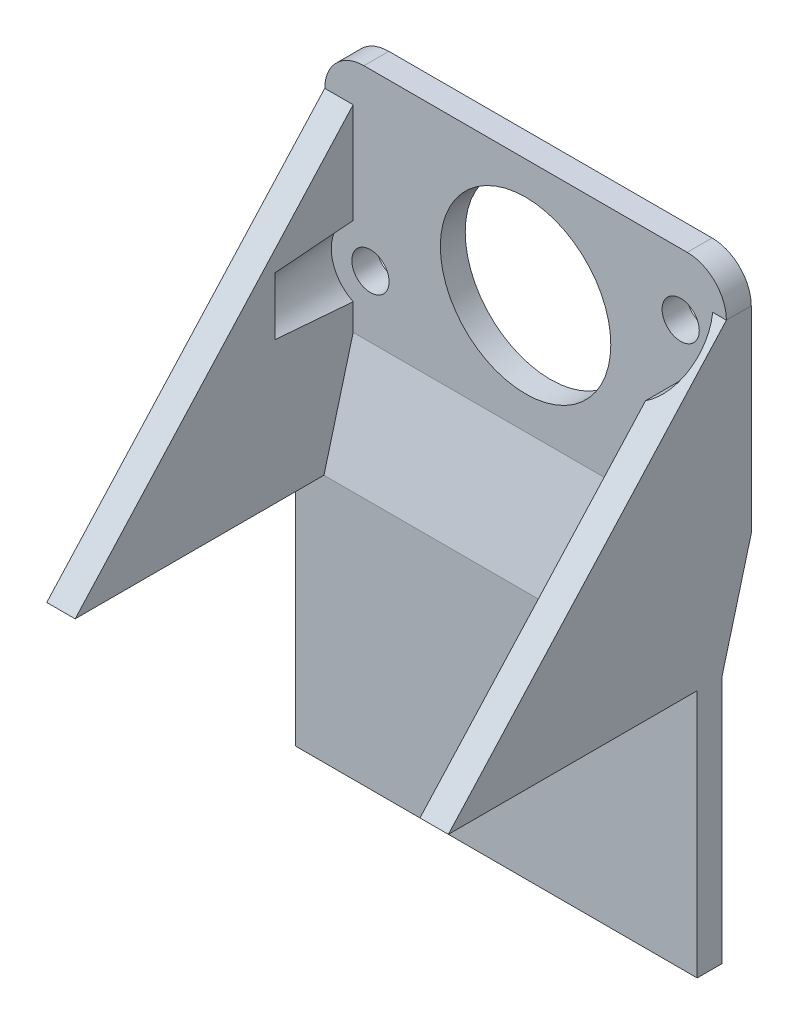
SolidWorks part; units mm, degrees
ref_plane "Front Plane" through (0, 0, 0) normal (0, 0, 1) x (1, 0, 0)
ref_plane "Top Plane" through (0, 0, 0) normal (0, 1, 0) x (1, 0, 0)
ref_plane "Right Plane" through (0, 0, 0) normal (1, 0, 0) x (0, 0, -1)
sketch "Sketch1" plane through (0, 0, 0) normal (0, 0, 1) x (1, 0, 0)
  line L1 (-51.25, -30.1625) -> (51.25, -30.1625)
  line L2 (-51.25, -30.1625) -> (-51.25, 30.1625)
  line L4 (51.25, -30.1625) -> (51.25, 30.1625)
  line L5 (-51.25, -30.1625) -> (51.25, 30.1625) construction
  line L6 (-51.25, 30.1625) -> (51.25, -30.1625) construction
  line L12 (0, 0) -> (50000, 0) construction
  line L13 (-51.25, 30.1625) -> (51.25, 30.1625)
  circle A2 centre (0, 0) radius 21.75
  point P0 (0, 0)
  point P19 (0, 0)
  dimension "D2" = 43.5
  dimension "D3" = 102.5
  dimension "D4" = 60.325
extrude "Boss-Extrude1" add sketch "Sketch1" along normal blind 6.35
sketch "Sketch4" [suppressed] plane through (0, 0, 0) normal (0, 0, 1) x (1, 0, 0)
  line L0 (51.25, 30.1625) -> (56.25, 30.1625)
  line L1 (-56.25, -30.1625) -> (-51.25, -30.1625)
  line L2 (-56.25, -30.1625) -> (-56.25, 30.1625)
  line L3 (-56.25, 30.1625) -> (-51.25, 30.1625)
  line L4 (56.25, -30.1625) -> (56.25, 30.1625)
  line L6 (-51.25, 30.1625) -> (-51.25, -30.1625)
  line L8 (51.25, 30.1625) -> (51.25, -30.1625)
  line L13 (51.25, -30.1625) -> (51.25, 30.1625) construction
  line L14 (51.25, -30.1625) -> (56.25, -30.1625)
  line L15 (-51.25, 30.1625) -> (-51.25, -30.1625) construction
  line L16 (51.25, 30.1625) -> (-51.25, 30.1625) construction
  line L17 (-51.25, -30.1625) -> (51.25, -30.1625) construction
  dimension "D1" = 5
fillet "Fillet1" radius 10 2 edges at (-51.25, 30.1625, 3.175) (51.25, 30.1625, 3.175)
sketch "Sketch5" plane through (0, 0, 0) normal (0, 0, 1) x (1, 0, 0)
  line L0 (-40.6896, -10.9028) -> (40.6896, 10.9028) construction
  line L2 (41.25, 30.1625) -> (-41.25, 30.1625) construction
  circle A0 centre (-40.6896, -10.9028) radius 4.75
  circle A1 centre (40.6896, 10.9028) radius 4.75
  point P8 (0, 0)
  dimension "9.5" = 9.5
  dimension "D1" = 15
  dimension "D2" = 84.25
sketch "Sketch2" plane through (0, 0, 0) normal (0, 0, 1) x (1, 0, 0)
  line L0 (-39.5846, -14.4076) -> (39.5846, 14.4076) construction
  line L1 (41.25, 30.1625) -> (-41.25, 30.1625) construction
  circle A0 centre (-39.5846, -14.4076) radius 4.75
  circle A1 centre (39.5846, 14.4076) radius 4.75
  point P8 (0, 0)
  dimension "9.5" = 9.5
  dimension "D1" = 20
  dimension "D2" = 84.25
extrude "Cut-Extrude1" cut sketch "Sketch2" along normal up to surface (6.35 mm away)
sketch "Sketch3" [suppressed] plane through (0, 0, 0) normal (0, 0, 1) x (1, 0, 0)
  line L0 (43.75, 0) -> (-43.75, 0) construction
  circle A0 centre (-43.75, 0) radius 4.75
  circle A1 centre (43.75, 0) radius 4.75
  point P9 (0, 0)
  dimension "D2" = 9.5
  dimension "D1" = 87.5
extrude "Cut-Extrude2" [suppressed] cut sketch "Sketch3" along normal up to surface (6.35 mm away)
extrude "Boss-Extrude2" [suppressed] add sketch "Sketch4" along normal up to surface (6.35 mm away)
fillet "Fillet2" [suppressed] radius 6
sketch "Sketch6" [suppressed] plane through (0, 0, 0) normal (1, 0, 0) x (0, 0, -1)
  line L0 (0, -30.1625) -> (12.55, -58)
  line L1 (12.55, -58) -> (12.55, -117.5)
  line L2 (12.55, -117.5) -> (6.2, -117.5)
  line L3 (6.2, -117.5) -> (6.2, -58)
  line L4 (6.2, -58) -> (-6.35, -30.1625)
  line L5 (0, -30.1625) -> (-6.35, -30.1625) construction
  line L7 (-6.35, -30.1625) -> (0, -30.1625)
  line L9 (-3.8, -119.5) -> (-3.8, -60) construction
extrude "Boss-Extrude3" [suppressed] add sketch "Sketch6" along normal mid plane 100
sketch "Sketch7" plane through (0, 0, 0) normal (1, 0, 0) x (0, 0, -1)
  line L0 (-6.35, -30.1625) -> (0, -30.1625)
  line L2 (0, -30.1625) -> (-7.45, -58)
  line L3 (-7.45, -58) -> (-7.45, -121.5)
  line L4 (-7.45, -121.5) -> (-13.8, -121.5)
  line L5 (-13.8, -121.5) -> (-13.8, -58)
  line L6 (-13.8, -58) -> (-6.35, -30.1625)
  line L7 (-13.8, -119.5) -> (-13.8, -60) construction
  line L8 (-13.8, -58) -> (-13.8, -121.5) construction
  point P3 (0, -30.1625)
  point P4 (0.9462, -30.1625)
  point P6 (0, -30.1625)
  point P14 (0, 0)
  point P17 (-4.9522, -30.1625)
  point P19 (0, 0)
  point P20 (-1.3049, -30.1625)
  point P21 (0, 0)
extrude "Boss-Extrude4" add sketch "Sketch7" along normal mid plane 102.5
sketch "Sketch8" plane through (0, 0, 0) normal (1, 0, 0) x (0, 0, -1)
  line L0 (-7.45, -121.5) -> (0, -30.1625)
  line L1 (0, -30.1625) -> (-7.45, -58)
  line L2 (-7.45, -58) -> (-7.45, -121.5)
  point P3 (0.7414, -31.0281)
  point P4 (1.5739, -32.4265)
  point P7 (0, -30.1625)
extrude "Boss-Extrude5" add sketch "Sketch8" along normal mid plane 80
sketch "Sketch9" plane through (0, 0, 0) normal (-1, 0, 0) x (0, 0, 1)
  line L0 (7.45, -121.5) -> (0, -30.1625)
  line L1 (0, -30.1625) -> (7.45, -58)
  line L2 (7.45, -58) -> (7.45, -121.5)
  line L3 (7.45, -121.5) -> (0, -30.1625) construction
  line L4 (6.35, -30.1625) -> (13.8, -58) construction
  line L5 (7.45, -121.5) -> (0, -30.1625) construction
  line L6 (7.45, -121.5) -> (7.45, -58) construction
  point P2 (0, -31.4003)
  point P6 (0, -30.1625)
extrude "Cut-Extrude3" cut sketch "Sketch9" against normal mid plane 65
sketch "Sketch10" [suppressed] plane through (0, 0, 0) normal (1, 0, 0) x (0, 0, -1)
  line L0 (-6.35, -30.1625) -> (-15.55, -58)
  line L1 (-15.55, -58) -> (6.2, -58)
  line L2 (-6.35, -30.1625) -> (6.2, -58) construction
  line L3 (6.2, -58) -> (-6.35, -30.1625)
  line L4 (-5.8, -58) -> (-65.3, -58) construction
  dimension "D1" = 21.75
sketch "Sketch12" [suppressed] plane through (0, 0, 0) normal (1, 0, 0) x (0, 0, -1)
  line L0 (-6.35, -30.1625) -> (-15.55, -58)
  line L1 (-15.55, -58) -> (6.2, -58)
  line L2 (6.2, -58) -> (-6.35, -30.1625)
extrude "Boss-Extrude6" [suppressed] add sketch "Sketch10" along normal mid plane 100
extrude "Cut-Extrude4" [suppressed] cut sketch "Sketch12" against normal mid plane 80
fillet "Fillet3" [suppressed] radius 10
sketch "Sketch13" plane through (0, 0, 0) normal (1, 0, 0) x (0, 0, -1)
  line L1 (-77.3, -58) -> (-13.8, -58)
  line L2 (-13.8, -58) -> (-6.35, -30.1625)
  line L4 (-6.35, -30.1625) -> (-13.8, -58) construction
  line L5 (-77.3, -58) -> (-6.35, 20.1625)
  line L6 (-6.35, 20.1625) -> (-6.35, -30.1625)
  point P2 (-6.35, -30.1625)
  point P5 (0, 0)
  point P10 (-6.35, 20.1625)
sketch "Sketch15" plane through (0, 0, 0) normal (1, 0, 0) x (0, 0, -1)
  line L1 (-6.35, -30.1625) -> (-13.8, -58)
  line L2 (-13.8, -58) -> (-77.3, -58)
  line L4 (-77.3, -58) -> (-6.35, 30.1625)
  line L5 (-6.35, 30.1625) -> (-6.35, 20.1625) construction
  line L6 (-6.35, 30.1625) -> (0, 30.1625) construction
  line L7 (-6.35, 30.1625) -> (-6.35, -30.1625)
extrude "Boss-Extrude7" add sketch "Sketch13" along normal mid plane 102.5
extrude "Cut-Extrude5" cut sketch "Sketch15" against normal mid plane 88
sketch "Sketch16" plane through (0, 0, 6.35) normal (0, 0, 1) x (1, 0, 0)
  circle A2 centre (39.5846, 14.4076) radius 10
  dimension "D1" = 20
extrude "Cut-Extrude6" cut sketch "Sketch16" along normal up to surface (5.2239 mm away)
sketch "Sketch17" plane through (0, 0, 6.35) normal (0, 0, 1) x (1, 0, 0)
  circle A0 centre (-39.5846, -14.4076) radius 10
  dimension "D1" = 20
extrude "Cut-Extrude7" cut sketch "Sketch17" along normal blind 20 draft 4
